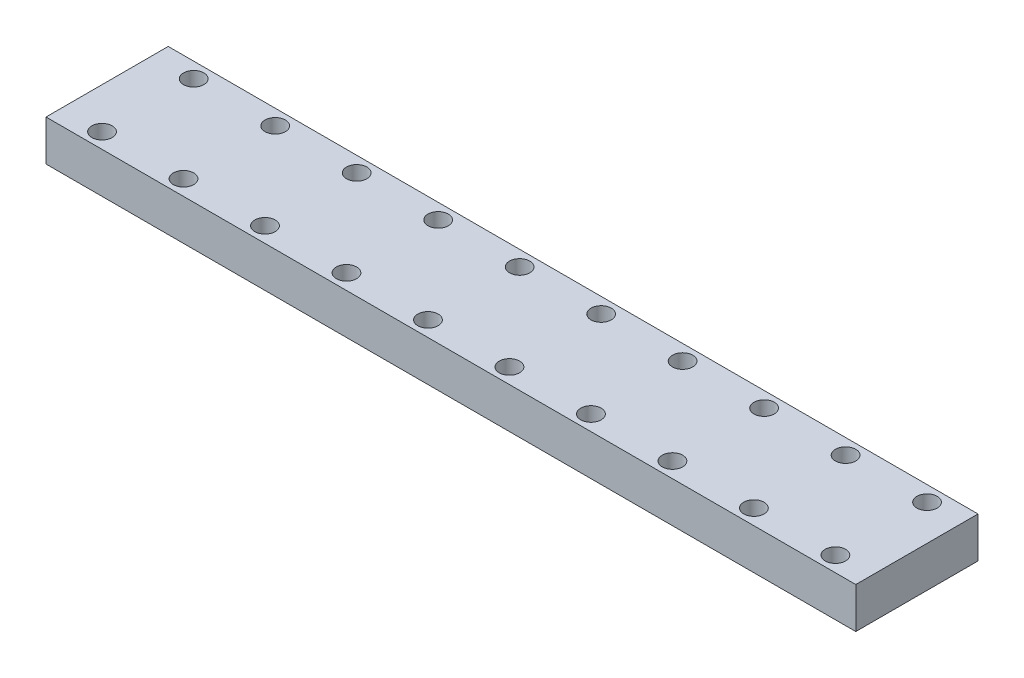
SolidWorks part; units mm, degrees
ref_plane "前视基准面" through (0, 0, 0) normal (0, 0, 1) x (1, 0, 0)
ref_plane "上视基准面" through (0, 0, 0) normal (0, 1, 0) x (1, 0, 0)
ref_plane "右视基准面" through (0, 0, 0) normal (1, 0, 0) x (0, 0, -1)
sketch "草图1" plane through (0, 0, 0) normal (0, 1, 0) x (1, 0, 0)
  line L1 (-24.7304, 11.1652) -> (134.2696, 11.1652)
  line L2 (-24.7304, 11.1652) -> (-24.7304, -12.8348)
  line L3 (-24.7304, -12.8348) -> (134.2696, -12.8348)
  line L4 (134.2696, 11.1652) -> (134.2696, -12.8348)
  circle A0 centre (-16.7304, 8.1652) radius 2
  circle A1 centre (-0.7304, 8.1652) radius 2
  circle A2 centre (15.2696, 8.1652) radius 2
  circle A3 centre (31.2696, 8.1652) radius 2
  circle A4 centre (47.2696, 8.1652) radius 2
  circle A5 centre (63.2696, 8.1652) radius 2
  circle A6 centre (79.2696, 8.1652) radius 2
  circle A7 centre (95.2696, 8.1652) radius 2
  circle A8 centre (111.2696, 8.1652) radius 2
  circle A9 centre (127.2696, 8.1652) radius 2
  circle A10 centre (-16.7304, -9.8348) radius 2
  circle A11 centre (-0.7304, -9.8348) radius 2
  circle A12 centre (15.2696, -9.8348) radius 2
  circle A13 centre (31.2696, -9.8348) radius 2
  circle A14 centre (47.2696, -9.8348) radius 2
  circle A15 centre (63.2696, -9.8348) radius 2
  circle A16 centre (79.2696, -9.8348) radius 2
  circle A17 centre (95.2696, -9.8348) radius 2
  circle A18 centre (111.2696, -9.8348) radius 2
  circle A19 centre (127.2696, -9.8348) radius 2
  dimension "D3" = 8
  dimension "D1" = 24
  dimension "D2" = 159
  dimension "D4" = 3
  dimension "D5" = 2
  dimension "D6" = 2
  dimension "D7" = 2
  dimension "D8" = 2
  dimension "D9" = 2
extrude "凸台-拉伸1" add sketch "草图1" along normal blind 8
